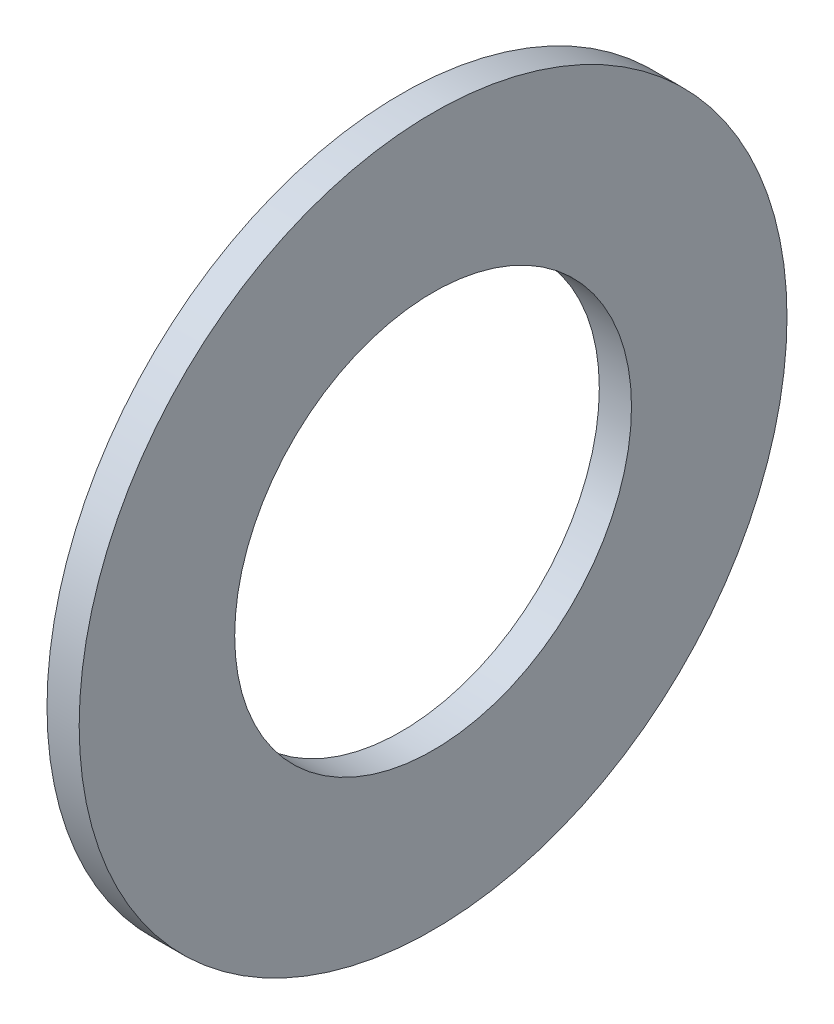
SolidWorks part; units mm, degrees
ref_plane "Plane1" through (0, 0, 0) normal (0, 0, 1) x (1, 0, 0)
ref_plane "Plane2" through (0, 0, 0) normal (0, 1, 0) x (1, 0, 0)
ref_plane "Plane3" through (0, 0, 0) normal (1, 0, 0) x (0, 0, -1)
other "Configuration Table"
sketch "Sketch1" plane through (0, 0, 0) normal (0, 0, 1) x (1, 0, 0)
  line L0 (-34.925, 0) -> (9.525, 0) construction
  line L1 (0, 18.5) -> (0, 33)
  line L2 (0, 33) -> (-3, 33)
  line L3 (-3, 33) -> (-3, 18.5)
  line L4 (-3, 18.5) -> (0, 18.5)
  dimension "Thickness" = 3
  dimension "Inside_dia" = 37
  dimension "Outside_dia" = 66
revolve "Base-Revolve" add sketch "Sketch1" angle 360 about L0
